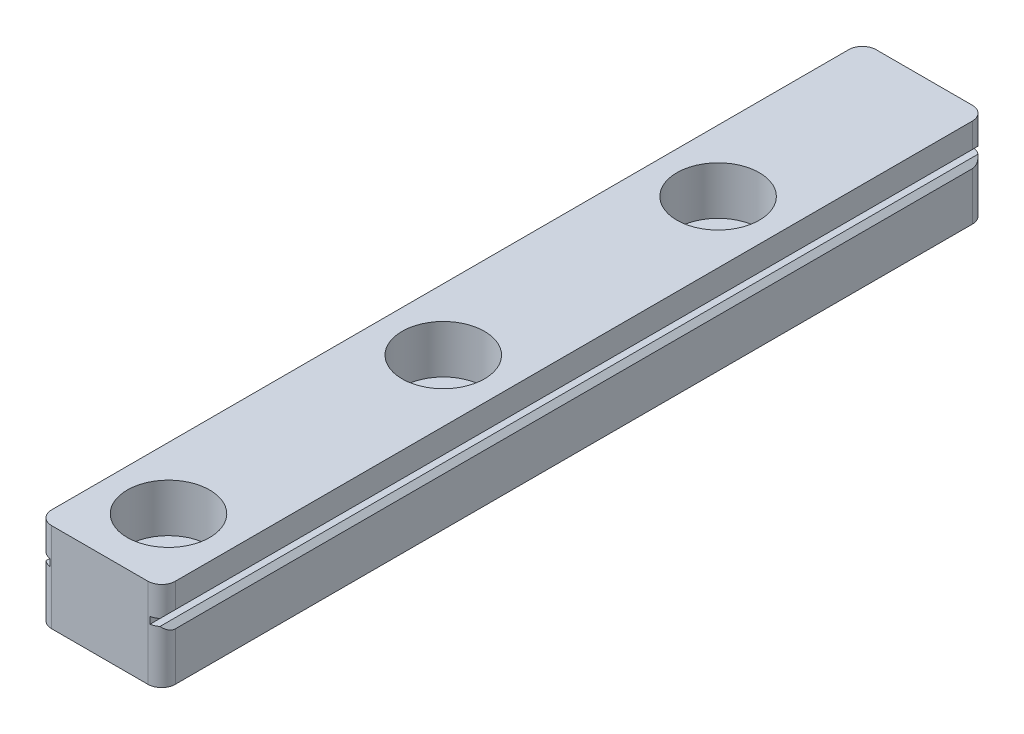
SolidWorks part; units mm, degrees
ref_plane "前视基准面" through (0, 0, 0) normal (0, 0, 1) x (1, 0, 0)
ref_plane "上视基准面" through (0, 0, 0) normal (0, 1, 0) x (1, 0, 0)
ref_plane "右视基准面" through (0, 0, 0) normal (1, 0, 0) x (0, 0, -1)
sketch "草图2" plane through (0, 0, 0) normal (0, 0, 1) x (1, 0, 0)
  line L0 (0, 0) -> (9, 0)
  line L1 (4.5, 0) -> (4.5, 7.3268) construction
  line L2 (9, 0) -> (9, 3.5)
  line L3 (9, 3.5) -> (8.6464, 3.8536)
  line L4 (8.6464, 3.8536) -> (8.1464, 3.8536)
  line L5 (8.1464, 3.8536) -> (8.1464, 4.3536)
  line L6 (8.1464, 4.3536) -> (8.6464, 4.3536)
  line L7 (8.6464, 4.3536) -> (9, 4.7071)
  line L8 (9, 4.7071) -> (9, 6.5)
  line L9 (9, 6.5) -> (0, 6.5)
  line L10 (0, 4.7071) -> (0, 6.5)
  line L11 (0.3536, 4.3536) -> (0, 4.7071)
  line L12 (0.8536, 4.3536) -> (0.3536, 4.3536)
  line L13 (0.8536, 3.8536) -> (0.8536, 4.3536)
  line L14 (0.3536, 3.8536) -> (0.8536, 3.8536)
  line L15 (0, 3.5) -> (0.3536, 3.8536)
  line L16 (0, 0) -> (0, 3.5)
  point P14 (4.5, 6.5)
  dimension "D1" = 9
  dimension "D2" = 3.5
  dimension "D3" = 135
  dimension "D4" = 0.5
  dimension "D5" = 0.5
  dimension "D6" = 0.5
  dimension "D7" = 0.5
  dimension "D8" = 6.5
extrude "凸台-拉伸2" add sketch "草图2" against normal blind 60
sketch "草图3" plane through (0, 6.5, 0) normal (0, 1, 0) x (1, 0, 0)
  line L0 (9, 0) -> (0, 0) construction
  circle A0 centre (4.5, 5) radius 3
  circle A1 centre (4.5, 25) radius 3
  circle A2 centre (4.5, 45) radius 3
  circle A3 centre (4.5, 65) radius 3
  circle A4 centre (4.5, 85) radius 3
  circle A5 centre (4.5, 105) radius 3
  circle A6 centre (4.5, 125) radius 3
  circle A7 centre (4.5, 45) radius 3
  circle A8 centre (4.5, 65) radius 3
  circle A9 centre (4.5, 85) radius 3
  circle A10 centre (4.5, 105) radius 3
  circle A11 centre (4.5, 125) radius 3
  circle A16 centre (4.5, 145) radius 3
  circle A17 centre (4.5, 165) radius 3
  circle A18 centre (4.5, 185) radius 3
  circle A19 centre (4.5, 205) radius 3
  circle A20 centre (4.5, 225) radius 3
  circle A29 centre (4.5, 145) radius 3
  circle A30 centre (4.5, 165) radius 3
  circle A31 centre (4.5, 185) radius 3
  circle A32 centre (4.5, 205) radius 3
  circle A33 centre (4.5, 305) radius 3
  circle A34 centre (4.5, 325) radius 3
  circle A35 centre (4.5, 345) radius 3
  circle A36 centre (4.5, 365) radius 3
  circle A37 centre (4.5, 385) radius 3
  circle A38 centre (4.5, 265) radius 3
  circle A39 centre (4.5, 285) radius 3
  circle A40 centre (4.5, 245) radius 3
  point P2 (4.5, 0)
  dimension "D1" = 6
  dimension "D4" = 6
  dimension "D2" = 5
  dimension "D5" = 20
  dimension "D3" = 20
  dimension "D6" = 9
extrude "切除-拉伸1" cut sketch "草图3" against normal blind 3.5
sketch "草图4" plane through (0, 3, 0) normal (0, 1, 0) x (1, 0, 0)
  circle A0 centre (4.5, 5) radius 1.75
  circle A1 centre (4.5, 25) radius 1.75
  circle A2 centre (4.5, 45) radius 1.75
  circle A3 centre (4.5, 65) radius 1.75
  circle A4 centre (4.5, 85) radius 1.75
  circle A5 centre (4.5, 105) radius 1.75
  circle A6 centre (4.5, 125) radius 1.75
  circle A7 centre (4.5, 65) radius 1.75
  circle A8 centre (4.5, 85) radius 1.75
  circle A9 centre (4.5, 105) radius 1.75
  circle A10 centre (4.5, 125) radius 1.75
  circle A11 centre (4.5, 45) radius 1.75
  circle A12 centre (4.5, 145) radius 1.75
  circle A13 centre (4.5, 165) radius 1.75
  circle A14 centre (4.5, 185) radius 1.75
  circle A15 centre (4.5, 205) radius 1.75
  circle A16 centre (4.5, 225) radius 1.75
  circle A25 centre (4.5, 265) radius 1.75
  circle A26 centre (4.5, 285) radius 1.75
  circle A27 centre (4.5, 305) radius 1.75
  circle A28 centre (4.5, 325) radius 1.75
  circle A29 centre (4.5, 345) radius 1.75
  circle A30 centre (4.5, 365) radius 1.75
  circle A31 centre (4.5, 385) radius 1.75
  circle A32 centre (4.5, 245) radius 1.75
  dimension "D1" = 3.5
  dimension "D3" = 3.5
  dimension "D2" = 7
  dimension "D4" = 18
extrude "切除-拉伸2" cut sketch "草图4" against normal up to surface (3 mm away)
fillet "圆角1" radius 1 4 edges at (9, 1.75, -60) (0, 1.75, -60) (9, 1.75, 0) (0, 1.75, 0)
